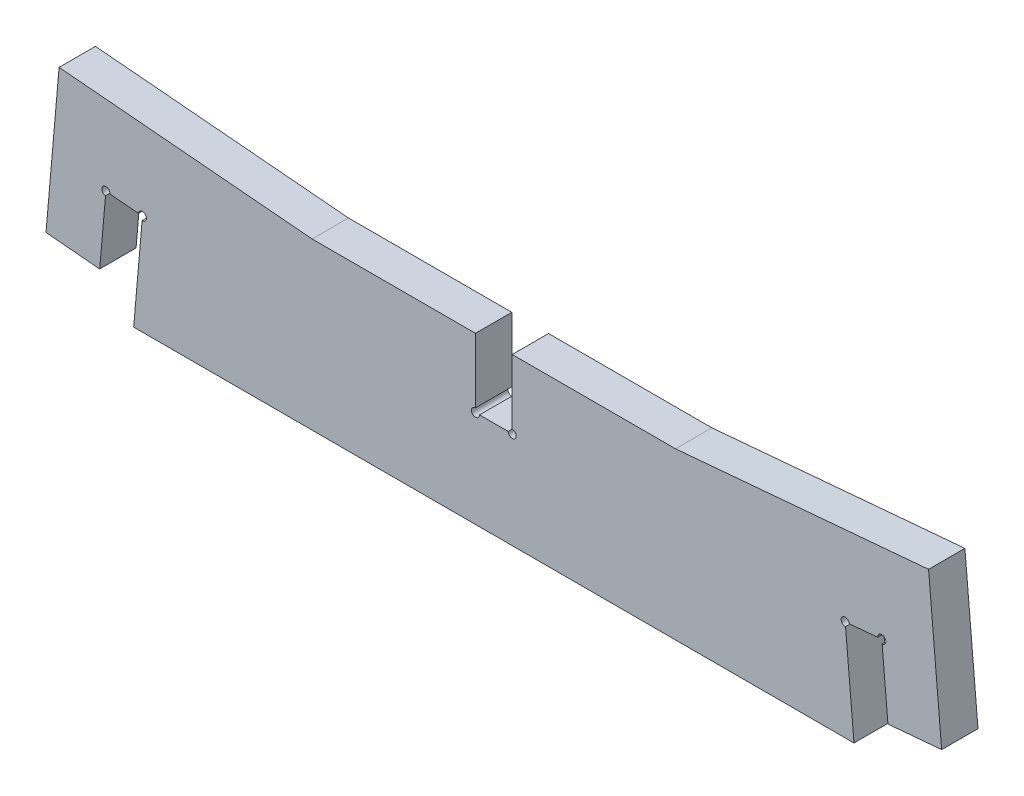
SolidWorks part; units mm, degrees
ref_plane "Front Plane" through (0, 0, 0) normal (0, 0, 1) x (1, 0, 0)
ref_plane "Top Plane" through (0, 0, 0) normal (0, 1, 0) x (1, 0, 0)
ref_plane "Right Plane" through (0, 0, 0) normal (1, 0, 0) x (0, 0, -1)
sketch "Sketch1" plane through (0, 0, 0) normal (0, 0, 1) x (1, 0, 0)
  line L0 (0, 132.9218) -> (0, -151.0159) construction
  line L1 (-178.3831, 0) -> (178.3831, 0)
  line L2 (178.3831, 0) -> (174.0253, 49.8097)
  line L3 (174.0253, 49.8097) -> (192.1561, 51.396)
  line L4 (192.1561, 51.396) -> (195.2065, 16.5292)
  line L5 (195.2065, 16.5292) -> (221.8049, 18.8562)
  line L6 (221.8049, 18.8562) -> (215.3213, 92.9642)
  line L7 (215.3213, 92.9642) -> (90, 82)
  line L8 (90, 82) -> (-90, 82)
  line L9 (178.9275, 98.1884) -> (188.1378, -7.0863) construction
  line L11 (-178.9275, 98.1884) -> (-188.1378, -7.0863) construction
  line L12 (-215.3213, 92.9642) -> (-90, 82)
  line L13 (-221.8049, 18.8562) -> (-215.3213, 92.9642)
  line L14 (-195.2065, 16.5292) -> (-221.8049, 18.8562)
  line L15 (-192.1561, 51.396) -> (-195.2065, 16.5292)
  line L16 (-174.0253, 49.8097) -> (-192.1561, 51.396)
  line L17 (-178.3831, 0) -> (-174.0253, 49.8097)
  point P3 (13.1848, 55.541)
  point P12 (208.5057, 17.6927)
  point P17 (-13.1848, 55.541)
  point P19 (0, 82)
  point P22 (0, 82)
  point P23 (0, 0)
  point P28 (0, 0)
  point P29 (0, 0)
  dimension "D1" = 18.2
  dimension "D2" = 26.7
  dimension "D3" = 35
  dimension "D4" = 82
  dimension "D5" = 85
  dimension "D6" = 90
  dimension "D7" = 90
  dimension "D8" = 15
extrude "Boss-Extrude1" add sketch "Sketch1" along normal blind 18
sketch "Sketch2" plane through (0, 0, 18) normal (0, 0, 1) x (1, 0, 0)
  line L0 (0, 119.9083) -> (0, -61.061) construction
  line L1 (9.1, 82) -> (9.1, 48)
  line L2 (90, 82) -> (-90, 82) construction
  line L3 (9.1, 48) -> (-9.1, 48)
  line L4 (-9.1, 82) -> (-9.1, 48)
  point P9 (0, 48)
  dimension "D1" = 18.2
  dimension "D2" = 34
extrude "Cut-Extrude1" cut sketch "Sketch2" against normal through all and the other way through all
sketch "Sketch3" plane through (0, 0, 18) normal (0, 0, 1) x (1, 0, 0)
  line L0 (178.3831, 0) -> (174.0253, 49.8097) construction
  line L1 (174.0253, 49.8097) -> (192.1561, 51.396) construction
  circle A0 centre (192.1561, 51.396) radius 2
  circle A1 centre (174.0253, 49.8097) radius 2
  circle A2 centre (9.1, 48) radius 2
  circle A3 centre (-9.1, 48) radius 2
  circle A4 centre (-174.0253, 49.8097) radius 2
  circle A5 centre (-192.1561, 51.396) radius 2
  dimension "D1" = 4
extrude "Cut-Extrude2" cut sketch "Sketch3" against normal up to next
